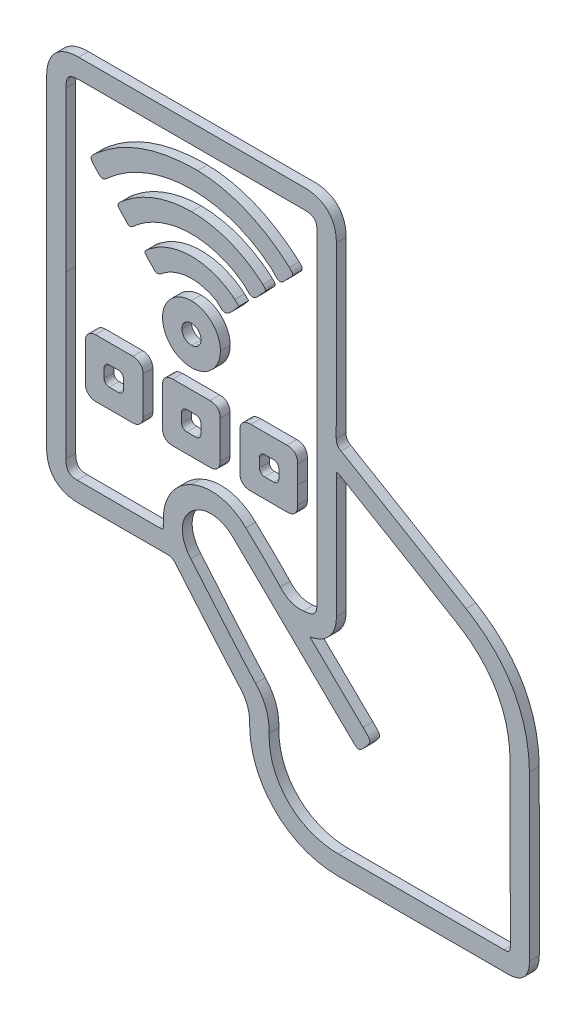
SolidWorks part; units mm, degrees
ref_plane "Plan de face" through (0, 0, 0) normal (0, 0, 1) x (1, 0, 0)
ref_plane "Plan de dessus" through (0, 0, 0) normal (0, 1, 0) x (1, 0, 0)
ref_plane "Plan de droite" through (0, 0, 0) normal (1, 0, 0) x (0, 0, -1)
sketch "Esquisse1" plane through (0, 0, 0) normal (0, 0, 1) x (1, 0, 0)
  line L26 (-7.513, -4.4846) -> (-7.513, -5.0939)
  line L27 (-13.2459, -2.8653) -> (-10.7497, -2.8653)
  line L28 (-13.9219, -3.5413) -> (-13.9219, -6.0371)
  line L29 (-13.2459, -6.7131) -> (-10.7497, -6.7131)
  line L30 (-10.0737, -3.5413) -> (-10.0737, -6.0371)
  line L31 (-7.175, -4.1466) -> (-6.5657, -4.1466)
  line L32 (-6.2277, -4.4846) -> (-6.2277, -5.0939)
  line L33 (-7.175, -5.4319) -> (-6.5657, -5.4319)
  line L34 (-12.6675, -4.4846) -> (-12.6675, -5.0939)
  line L35 (-12.3295, -4.1466) -> (-11.7202, -4.1466)
  line L36 (-11.3822, -4.4846) -> (-11.3822, -5.0939)
  line L37 (-12.3295, -5.4319) -> (-11.7202, -5.4319)
  line L38 (-2.3316, -4.4846) -> (-2.3316, -5.0939)
  line L39 (-1.9936, -4.1466) -> (-1.3843, -4.1466)
  line L40 (-1.0463, -4.4846) -> (-1.0463, -5.0939)
  line L41 (-1.9936, -5.4319) -> (-1.3843, -5.4319)
  arc A4 (-13.2459, -2.8653) -> (-13.9219, -3.5413) centre (-13.2459, -3.5413) ccw
  arc A5 (-13.9219, -6.0371) -> (-13.2459, -6.7131) centre (-13.2459, -6.0371) ccw
  arc A6 (-10.7497, -6.7131) -> (-10.0737, -6.0371) centre (-10.7497, -6.0371) ccw
  arc A7 (-10.7497, -2.8653) -> (-10.0737, -3.5413) centre (-10.7497, -3.5413) cw
  arc A8 (-7.175, -4.1466) -> (-7.513, -4.4846) centre (-7.175, -4.4846) ccw
  arc A9 (-7.513, -5.0939) -> (-7.175, -5.4319) centre (-7.175, -5.0939) ccw
  arc A10 (-6.5657, -4.1466) -> (-6.2277, -4.4846) centre (-6.5657, -4.4846) cw
  arc A11 (-6.5657, -5.4319) -> (-6.2277, -5.0939) centre (-6.5657, -5.0939) ccw
  arc A12 (-12.3295, -4.1466) -> (-12.6675, -4.4846) centre (-12.3295, -4.4846) ccw
  arc A13 (-12.6675, -5.0939) -> (-12.3295, -5.4319) centre (-12.3295, -5.0939) ccw
  arc A14 (-11.7202, -4.1466) -> (-11.3822, -4.4846) centre (-11.7202, -4.4846) cw
  arc A15 (-11.7202, -5.4319) -> (-11.3822, -5.0939) centre (-11.7202, -5.0939) ccw
  arc A16 (-1.9936, -4.1466) -> (-2.3316, -4.4846) centre (-1.9936, -4.4846) ccw
  arc A17 (-2.3316, -5.0939) -> (-1.9936, -5.4319) centre (-1.9936, -5.0939) ccw
  arc A18 (-1.3843, -4.1466) -> (-1.0463, -4.4846) centre (-1.3843, -4.4846) cw
  arc A19 (-1.3843, -5.4319) -> (-1.0463, -5.0939) centre (-1.3843, -5.0939) ccw
  spline S0 degree 3 poles (-15.2111, 10.3507) (-15.2114, 6.8173) (-15.2112, 3.2839) (-15.2112, -0.2496) knots 13 13 13 13 14 14 14 14
  spline S1 degree 3 poles (-14.2901, 11.2765) (-15.0263, 11.2764) (-15.211, 11.0907) (-15.2111, 10.3507) knots 12 12 12 12 13 13 13 13
  spline S2 degree 3 poles (0.6066, 11.2764) (-4.359, 11.2768) (-9.3245, 11.2768) (-14.2901, 11.2765) knots 11 11 11 11 12 12 12 12
  spline S3 degree 3 poles (1.497, 10.4) (1.4969, 11.0774) (1.2942, 11.2763) (0.6066, 11.2764) knots 10 10 10 10 11 11 11 11
  spline S4 degree 3 poles (1.4971, -10.9613) (1.4975, -3.8409) (1.4975, 3.2795) (1.497, 10.4) knots 9 9 9 9 10 10 10 10
  spline S5 degree 3 poles (0.5869, -11.8708) (1.2977, -11.8144) (1.497, -11.6655) (1.4971, -10.9613) knots 8 8 8 8 9 9 9 9
  spline S6 degree 3 poles (-0.9493, -11.2527) (-0.5115, -11.7275) (-0.0535, -11.9217) (0.5869, -11.8708) knots 7 7 7 7 8 8 8 8
  spline S7 degree 3 poles (-3.2385, -9.0005) (-2.4684, -9.7444) (-1.674, -10.4666) (-0.9493, -11.2527) knots 6 6 6 6 7 7 7 7
  spline S8 degree 3 poles (-6.9014, -8.3331) (-5.6545, -7.7517) (-4.2739, -8.0004) (-3.2385, -9.0005) knots 5 5 5 5 6 6 6 6
  spline S9 degree 3 poles (-8.7213, -11.5735) (-8.8422, -10.1451) (-8.1392, -8.9102) (-6.9014, -8.3331) knots 4 4 4 4 5 5 5 5
  spline S10 degree 3 poles (-8.9913, -11.8622) (-8.7681, -11.8631) (-8.7006, -11.8184) (-8.7213, -11.5735) knots 3 3 3 3 4 4 4 4
  spline S11 degree 3 poles (-14.4521, -11.8564) (-12.6318, -11.8609) (-10.8116, -11.855) (-8.9913, -11.8622) knots 2 2 2 2 3 3 3 3
  spline S12 degree 3 poles (-15.2107, -11.0105) (-15.2105, -11.6118) (-14.9981, -11.855) (-14.4521, -11.8564) knots 1 1 1 1 2 2 2 2
  spline S13 degree 3 poles (-15.2112, -0.2496) (-15.2112, -3.8366) (-15.2117, -7.4236) (-15.2107, -11.0105) knots 0 0 0 0 1 1 1 1
  spline S14 degree 3 poles (2.0333, -12.73) (1.7574, -12.9549) (1.4244, -13.052) (1.0243, -13.1561) knots 18 18 18 18 19 19 19 19
  spline S15 degree 3 poles (2.7839, -11.1174) (2.7848, -11.7758) (2.5448, -12.3133) (2.0333, -12.73) knots 17 17 17 17 18 18 18 18
  spline S16 degree 3 poles (2.7826, -3.205) (2.7825, -5.8425) (2.7805, -8.4799) (2.7839, -11.1174) knots 16 16 16 16 17 17 17 17
  spline S17 degree 3 poles (2.7826, -2.781) (2.7826, -2.9182) (2.7826, -3.0616) (2.7826, -3.205) knots 15 15 15 15 16 16 16 16
  spline S18 degree 3 poles (3.1032, -2.8899) (3.0158, -2.8381) (2.9389, -2.7467) (2.7826, -2.781) knots 14 14 14 14 15 15 15 15
  spline S19 degree 3 poles (10.832, -7.4769) (8.2683, -5.9271) (5.6814, -4.4157) (3.1032, -2.8899) knots 13 13 13 13 14 14 14 14
  spline S20 degree 3 poles (14.3447, -13.6658) (14.3284, -10.9604) (13.1477, -8.8768) (10.832, -7.4769) knots 12 12 12 12 13 13 13 13
  spline S21 degree 3 poles (14.3585, -24.3092) (14.3446, -20.7614) (14.3661, -17.2135) (14.3447, -13.6658) knots 11 11 11 11 12 12 12 12
  spline S22 degree 3 poles (13.9337, -24.7184) (14.2571, -24.7194) (14.3599, -24.6549) (14.3585, -24.3092) knots 10 10 10 10 11 11 11 11
  spline S23 degree 3 poles (2.9287, -24.7096) (6.597, -24.7147) (10.2654, -24.7066) (13.9337, -24.7184) knots 9 9 9 9 10 10 10 10
  spline S24 degree 3 poles (-1.6941, -20.0762) (-1.7466, -22.7553) (0.2433, -24.7059) (2.9287, -24.7096) knots 8 8 8 8 9 9 9 9
  spline S25 degree 3 poles (-2.5866, -17.6357) (-1.9237, -18.3635) (-1.675, -19.1006) (-1.6941, -20.0762) knots 7 7 7 7 8 8 8 8
  spline S26 degree 3 poles (-6.9035, -12.6097) (-5.4689, -14.289) (-4.0732, -16.0037) (-2.5866, -17.6357) knots 6 6 6 6 7 7 7 7
  spline S27 degree 3 poles (-6.8801, -9.8685) (-7.6479, -10.5888) (-7.6557, -11.7292) (-6.9035, -12.6097) knots 5 5 5 5 6 6 6 6
  spline S28 degree 3 poles (-4.0977, -9.9667) (-4.9204, -9.1678) (-6.0992, -9.1358) (-6.8801, -9.8685) knots 4 4 4 4 5 5 5 5
  spline S29 degree 3 poles (3.9234, -17.7911) (1.2599, -15.1725) (-1.418, -12.5687) (-4.0977, -9.9667) knots 3 3 3 3 4 4 4 4
  spline S30 degree 3 poles (4.598, -17.7741) (4.3436, -18.0596) (4.2052, -18.0682) (3.9234, -17.7911) knots 2 2 2 2 3 3 3 3
  spline S31 degree 3 poles (4.5605, -16.5923) (5.1609, -17.1751) (5.1457, -17.1597) (4.598, -17.7741) knots 1 1 1 1 2 2 2 2
  spline S32 degree 3 poles (1.0243, -13.1561) (2.2386, -14.3362) (3.3989, -15.4649) (4.5605, -16.5923) knots 0 0 0 0 1 1 1 1
  spline S33 degree 3 poles (-16.4962, -10.99) (-16.4971, -7.4162) (-16.4965, -3.8425) (-16.4965, -0.2688) knots 17 17 17 17 18 18 18 18
  spline S34 degree 3 poles (-14.3264, -13.1433) (-15.7214, -13.1427) (-16.4958, -12.3747) (-16.4962, -10.99) knots 16 16 16 16 17 17 17 17
  spline S35 degree 3 poles (-8.4639, -13.138) (-10.4181, -13.1477) (-12.3723, -13.1441) (-14.3264, -13.1433) knots 15 15 15 15 16 16 16 16
  spline S36 degree 3 poles (-7.9229, -13.3884) (-8.0761, -13.2074) (-8.2272, -13.1368) (-8.4639, -13.138) knots 14 14 14 14 15 15 15 15
  spline S37 degree 3 poles (-3.614, -18.4193) (-5.0807, -16.7693) (-6.4966, -15.074) (-7.9229, -13.3884) knots 13 13 13 13 14 14 14 14
  spline S38 degree 3 poles (-2.9859, -20.1352) (-2.9812, -19.4498) (-3.1542, -18.9365) (-3.614, -18.4193) knots 12 12 12 12 13 13 13 13
  spline S39 degree 3 poles (2.8517, -25.9943) (-0.451, -25.9875) (-3.0088, -23.4375) (-2.9859, -20.1352) knots 11 11 11 11 12 12 12 12
  spline S40 degree 3 poles (14.1752, -25.9956) (10.4007, -25.997) (6.6262, -26.0022) (2.8517, -25.9943) knots 10 10 10 10 11 11 11 11
  spline S41 degree 3 poles (15.6347, -24.5307) (15.6344, -25.487) (15.1282, -25.9952) (14.1752, -25.9956) knots 9 9 9 9 10 10 10 10
  spline S42 degree 3 poles (15.6279, -13.649) (15.6595, -17.276) (15.636, -20.9035) (15.6347, -24.5307) knots 8 8 8 8 9 9 9 9
  spline S43 degree 3 poles (11.4151, -6.3236) (14.1732, -7.9778) (15.5999, -10.4326) (15.6279, -13.649) knots 7 7 7 7 8 8 8 8
  spline S44 degree 3 poles (3.0948, -1.4019) (5.8727, -3.0349) (8.6516, -4.6663) (11.4151, -6.3236) knots 6 6 6 6 7 7 7 7
  spline S45 degree 3 poles (2.7761, -0.836) (2.7754, -1.1102) (2.8578, -1.2626) (3.0948, -1.4019) knots 5 5 5 5 6 6 6 6
  spline S46 degree 3 poles (2.782, 10.4474) (2.7836, 6.6863) (2.7857, 2.9251) (2.7761, -0.836) knots 4 4 4 4 5 5 5 5
  spline S47 degree 3 poles (-14.3636, 12.5615) (-9.3577, 12.5624) (-4.3518, 12.5624) (0.6541, 12.5615) (1.9916, 12.5613) (2.7815, 11.7773) (2.782, 10.4474) knots 2 2 2 2 3 3 3 4 4 4 4
  spline S48 degree 3 poles (-16.4962, 10.4123) (-16.4959, 11.7785) (-15.7198, 12.5613) (-14.3636, 12.5615) knots 1 1 1 1 2 2 2 2
  spline S49 degree 3 poles (-16.4965, -0.2688) (-16.4965, 3.2916) (-16.497, 6.8519) (-16.4962, 10.4123) knots 0 0 0 0 1 1 1 1
  spline S50 degree 3 poles (-13.0125, 7.768) (-11.2615, 9.218) (-9.1069, 9.9944) (-6.4491, 9.9905) knots 7 7 7 7 8 8 8 8
  spline S51 degree 3 poles (-13.0819, 6.5633) (-13.6938, 7.2051) (-13.7037, 7.1956) (-13.0125, 7.768) knots 6 6 6 6 7 7 7 7
  spline S52 degree 3 poles (-12.4599, 6.534) (-12.7352, 6.283) (-12.8575, 6.3278) (-13.0819, 6.5633) knots 5 5 5 5 6 6 6 6
  spline S53 degree 3 poles (-1.5793, 6.8324) (-4.7416, 9.437) (-9.4047, 9.3196) (-12.4599, 6.534) knots 4 4 4 4 5 5 5 5
  spline S54 degree 3 poles (-0.9412, 6.34) (-1.1749, 6.3087) (-1.3654, 6.6562) (-1.5793, 6.8324) knots 3 3 3 3 4 4 4 4
  spline S55 degree 3 poles (-0.3254, 6.8784) (-0.5444, 6.7068) (-0.7169, 6.37) (-0.9412, 6.34) knots 2 2 2 2 3 3 3 3
  spline S56 degree 3 poles (-0.3437, 7.4624) (-0.1051, 7.2486) (-0.0457, 7.0974) (-0.3254, 6.8784) knots 1 1 1 1 2 2 2 2
  spline S57 degree 3 poles (-6.4491, 9.9905) (-4.3641, 9.9519) (-2.1951, 9.1214) (-0.3437, 7.4624) knots 0 0 0 0 1 1 1 1
  spline S58 degree 3 poles (-11.3067, 5.8401) (-10.0094, 6.8816) (-8.5243, 7.399) (-6.8567, 7.4255) knots 8 8 8 8 9 9 9 9
  spline S59 degree 3 poles (-11.3746, 4.8721) (-11.8775, 5.3772) (-11.8798, 5.3801) (-11.3067, 5.8401) knots 7 7 7 7 8 8 8 8
  spline S60 degree 3 poles (-11.2062, 4.7006) (-11.2532, 4.7644) (-11.318, 4.8152) (-11.3746, 4.8721) knots 6 6 6 6 7 7 7 7
  spline S61 degree 3 poles (-10.6749, 4.679) (-10.9044, 4.4737) (-11.0348, 4.4679) (-11.2062, 4.7006) knots 5 5 5 5 6 6 6 6
  spline S62 degree 3 poles (-3.4237, 5.01) (-5.6189, 6.6211) (-8.6431, 6.4961) (-10.6749, 4.679) knots 4 4 4 4 5 5 5 5
  spline S63 degree 3 poles (-2.741, 4.5282) (-2.9991, 4.4736) (-3.1924, 4.8403) (-3.4237, 5.01) knots 3 3 3 3 4 4 4 4
  spline S64 degree 3 poles (-2.0974, 5.1043) (-2.3232, 4.9179) (-2.4975, 4.5798) (-2.741, 4.5282) knots 2 2 2 2 3 3 3 3
  spline S65 degree 3 poles (-2.1074, 5.5944) (-1.8946, 5.4075) (-1.8744, 5.2882) (-2.0974, 5.1043) knots 1 1 1 1 2 2 2 2
  spline S66 degree 3 poles (-6.8567, 7.4255) (-5.0533, 7.3975) (-3.4699, 6.7909) (-2.1074, 5.5944) knots 0 0 0 0 1 1 1 1
  spline S67 degree 3 poles (-6.8772, -4.1466) (-6.9439, -4.1466) (-7.0126, -4.1572) (-7.0769, -4.1449) knots 1 1 1 1 2 2 2 2
  spline S68 degree 3 poles (-8.7918, -6.0201) (-8.8032, -5.6054) (-8.7943, -5.1902) (-8.7942, -4.7752) knots 8 8 8 8 9 9 9 9
  spline S69 degree 3 poles (-8.1158, -6.7026) (-8.5417, -6.6967) (-8.7801, -6.4487) (-8.7918, -6.0201) knots 7 7 7 7 8 8 8 8
  spline S70 degree 3 poles (-5.6261, -6.7029) (-6.4559, -6.7136) (-7.286, -6.714) (-8.1158, -6.7026) knots 6 6 6 6 7 7 7 7
  spline S71 degree 3 poles (-4.9437, -6.0267) (-4.9496, -6.4522) (-5.1981, -6.6974) (-5.6261, -6.7029) knots 5 5 5 5 6 6 6 6
  spline S72 degree 3 poles (-4.9433, -3.537) (-4.9326, -4.3668) (-4.9322, -5.1969) (-4.9437, -6.0267) knots 4 4 4 4 5 5 5 5
  spline S73 degree 3 poles (-5.6195, -2.8552) (-5.194, -2.8609) (-4.9489, -3.1085) (-4.9433, -3.537) knots 3 3 3 3 4 4 4 4
  spline S74 degree 3 poles (-8.1092, -2.8549) (-7.2794, -2.8444) (-6.4493, -2.8441) (-5.6195, -2.8552) knots 2 2 2 2 3 3 3 3
  spline S75 degree 3 poles (-8.7916, -3.5304) (-8.7792, -3.1039) (-8.5385, -2.8603) (-8.1092, -2.8549) knots 1 1 1 1 2 2 2 2
  spline S76 degree 3 poles (-8.7942, -4.7752) (-8.7942, -4.3603) (-8.8036, -3.945) (-8.7916, -3.5304) knots 0 0 0 0 1 1 1 1
  spline S77 degree 3 poles (0.2103, -3.5937) (0.2177, -3.9952) (0.2118, -4.3969) (0.2118, -4.7985) knots 8 8 8 8 9 9 9 9
  spline S78 degree 3 poles (-0.5019, -2.864) (-0.0325, -2.8691) (0.2014, -3.1148) (0.2103, -3.5937) knots 7 7 7 7 8 8 8 8
  spline S79 degree 3 poles (-2.9114, -2.8635) (-2.1083, -2.8564) (-1.305, -2.8553) (-0.5019, -2.864) knots 6 6 6 6 7 7 7 7
  spline S80 degree 3 poles (-3.6411, -3.5745) (-3.6359, -3.1046) (-3.3907, -2.8677) (-2.9114, -2.8635) knots 5 5 5 5 6 6 6 6
  spline S81 degree 3 poles (-3.6416, -5.9839) (-3.6487, -5.1808) (-3.6498, -4.3775) (-3.6411, -3.5745) knots 4 4 4 4 5 5 5 5
  spline S82 degree 3 poles (-2.9306, -6.7143) (-3.3998, -6.7091) (-3.6374, -6.4626) (-3.6416, -5.9839) knots 3 3 3 3 4 4 4 4
  spline S83 degree 3 poles (-0.5212, -6.7149) (-1.3243, -6.7224) (-2.1276, -6.7233) (-2.9306, -6.7143) knots 2 2 2 2 3 3 3 3
  spline S84 degree 3 poles (0.2107, -5.963) (0.203, -6.4672) (-0.0282, -6.7103) (-0.5212, -6.7149) knots 1 1 1 1 2 2 2 2
  spline S85 degree 3 poles (0.2118, -4.7985) (0.2119, -5.1866) (0.2166, -5.5749) (0.2107, -5.963) knots 0 0 0 0 1 1 1 1
  spline S86 degree 3 poles (-6.8508, -0.2879) (-6.5053, -0.2841) (-6.2188, 0.0038) (-6.2175, 0.3485) knots 3 3 3 3 4 4 4 4
  spline S87 degree 3 poles (-7.4973, 0.3354) (-7.4881, -0.0095) (-7.1953, -0.2917) (-6.8508, -0.2879) knots 2 2 2 2 3 3 3 3
  spline S88 degree 3 poles (-6.8446, 0.9916) (-7.205, 1) (-7.5069, 0.6964) (-7.4973, 0.3354) knots 1 1 1 1 2 2 2 2
  spline S89 degree 3 poles (-6.2175, 0.3485) (-6.2161, 0.6937) (-6.4988, 0.9835) (-6.8446, 0.9916) knots 0 0 0 0 1 1 1 1
  spline S90 degree 3 poles (-8.7833, 0.3642) (-8.7831, 1.4089) (-7.9124, 2.279) (-6.8677, 2.2784) knots 3 3 3 3 4 4 4 4
  spline S91 degree 3 poles (-6.8483, -1.5728) (-7.9141, -1.5775) (-8.7834, -0.7073) (-8.7833, 0.3642) knots 2 2 2 2 3 3 3 3
  spline S92 degree 3 poles (-4.9322, 0.342) (-4.9368, -0.7074) (-5.7982, -1.5682) (-6.8483, -1.5728) knots 1 1 1 1 2 2 2 2
  spline S93 degree 3 poles (-6.8677, 2.2784) (-5.7965, 2.2777) (-4.9275, 1.4084) (-4.9322, 0.342) knots 0 0 0 0 1 1 1 1
  spline S94 degree 3 poles (-3.9746, 3.7977) (-3.8839, 3.7211) (-3.8014, 3.6346) (-3.7015, 3.5399) knots 8 8 8 8 9 9 9 9
  spline S95 degree 3 poles (-9.5363, 3.9565) (-7.8701, 5.2012) (-5.558, 5.1358) (-3.9746, 3.7977) knots 7 7 7 7 8 8 8 8
  spline S96 degree 3 poles (-9.6111, 3.1084) (-10.069, 3.5586) (-10.069, 3.5586) (-9.5363, 3.9565) knots 6 6 6 6 7 7 7 7
  spline S97 degree 3 poles (-9.4415, 2.9383) (-9.4888, 3.0019) (-9.554, 3.0522) (-9.6111, 3.1084) knots 5 5 5 5 6 6 6 6
  spline S98 degree 3 poles (-8.807, 2.8803) (-9.0919, 2.6532) (-9.2489, 2.6792) (-9.4415, 2.9383) knots 4 4 4 4 5 5 5 5
  spline S99 degree 3 poles (-5.2351, 3.135) (-6.3807, 3.7749) (-7.7637, 3.7118) (-8.807, 2.8803) knots 3 3 3 3 4 4 4 4
  spline S100 degree 3 poles (-4.4916, 2.7494) (-4.8179, 2.5931) (-4.9885, 2.9973) (-5.2351, 3.135) knots 2 2 2 2 3 3 3 3
  spline S101 degree 3 poles (-3.8272, 3.3791) (-4.0442, 3.1616) (-4.2296, 2.875) (-4.4916, 2.7494) knots 1 1 1 1 2 2 2 2
  spline S102 degree 3 poles (-3.7015, 3.5399) (-3.7492, 3.4782) (-3.7829, 3.4234) (-3.8272, 3.3791) knots 0 0 0 0 1 1 1 1
extrude "Boss.-Extru.1" add sketch "Esquisse1" along normal blind 0.65
